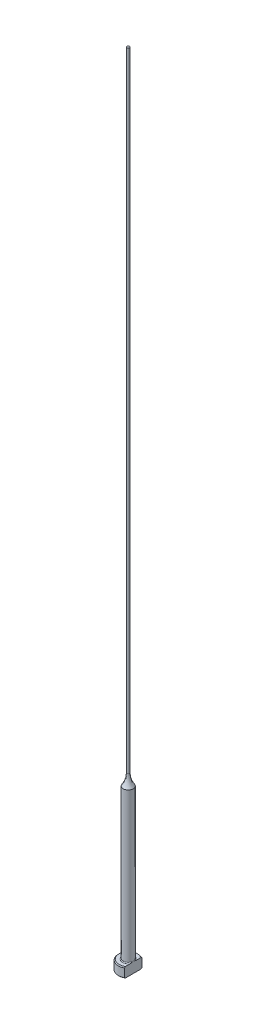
SolidWorks part; units mm, degrees
ref_plane "Front Plane" through (0, 0, 0) normal (0, 0, 1) x (1, 0, 0)
ref_plane "Top Plane" through (0, 0, 0) normal (0, 1, 0) x (1, 0, 0)
ref_plane "Right Plane" through (0, 0, 0) normal (1, 0, 0) x (0, 0, -1)
sketch "Sketch1" plane through (0, 0, 0) normal (0, 0, 1) x (1, 0, 0)
  line L0 (0, 259.9588) -> (0, -15.1925) construction
  line L1 (0, 0) -> (-3.175, 0)
  line L2 (-3.175, 0) -> (-3.175, 3.175)
  line L3 (-3.175, 3.175) -> (-1.5875, 3.175)
  line L4 (-0.3962, 54.5027) -> (-0.3962, 254)
  line L5 (-0.3962, 254) -> (0, 254)
  line L6 (0, 254) -> (0, 0)
  line L7 (-1.5875, 3.175) -> (-1.5875, 50.8)
  arc A0 (-1.5875, 50.8) -> (-0.3962, 54.5027) centre (-6.7462, 54.5027) ccw
  point P13 (-1.5875, 0)
  dimension "D1" = 6.35
  dimension "L" = 254
  dimension "D2" = 3.175
  dimension "H" = 6.35
  dimension "T" = 3.175
  dimension "D" = 0.7925
  dimension "S" = 50.8
revolve "Revolve1" add sketch "Sketch1" angle 360 about L0
chamfer "Chamfer1" distance 0.254 angle 45 2 edges at (0, 3.175, 3.175) (0, 0, 3.175)
fillet "Fillet1" radius 0.254 1 edges at (0, 3.175, 1.5875)
sketch "Sketch2" plane through (0, 0, 0) normal (0, 1, 0) x (1, 0, 0)
  line L0 (1.5875, -2.7496) -> (1.5875, 2.7496)
  circle A0 centre (0, 0) radius 3.175 construction
  arc A2 (1.5875, -2.7496) -> (1.5875, 2.7496) centre (0, 0) ccw
  circle A3 centre (0, 0) radius 3.175 construction
  circle A4 centre (0, 0) radius 1.5875 construction
extrude "Key Head" cut sketch "Sketch2" along normal up to next
